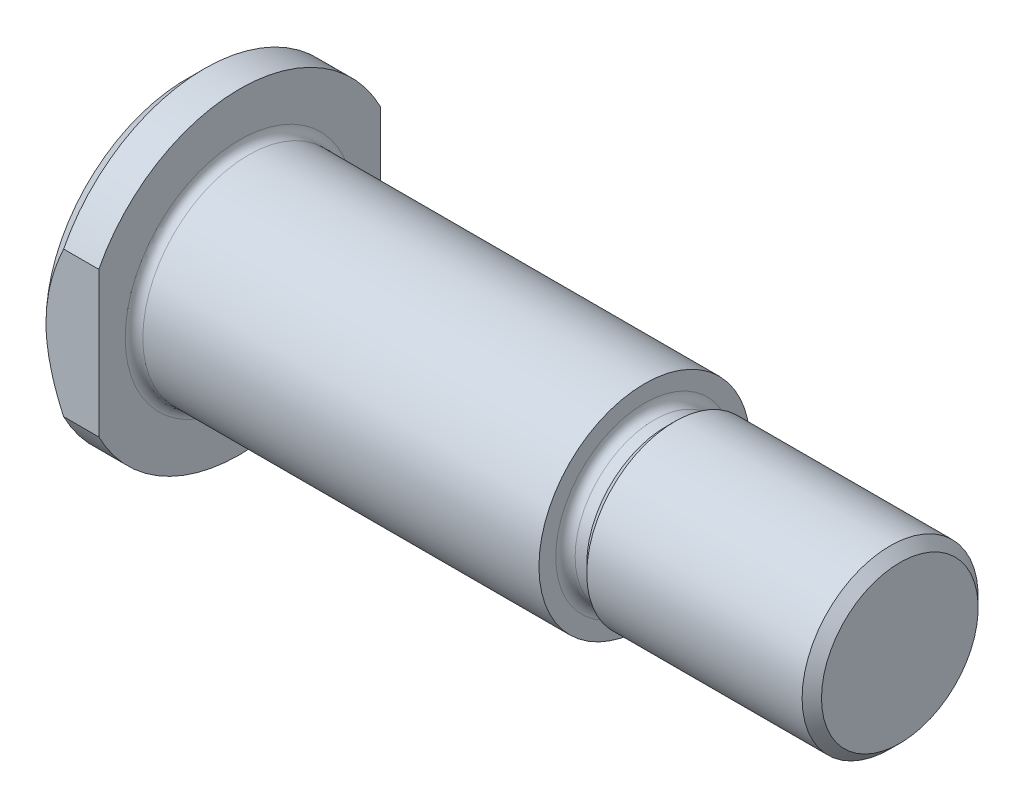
SolidWorks part; units mm, degrees
ref_plane "Plane1" through (0, 0, 0) normal (0, 0, 1) x (1, 0, 0)
ref_plane "Plane2" through (0, 0, 0) normal (0, 1, 0) x (1, 0, 0)
ref_plane "Plane3" through (0, 0, 0) normal (1, 0, 0) x (0, 0, -1)
sketch "BodySke" plane through (0, 0, 0) normal (0, 0, 1) x (1, 0, 0)
  line L0 (0, 0) -> (0, 16)
  line L1 (0, 16) -> (2, 18)
  line L2 (2, 18) -> (6, 18)
  line L3 (6, 18) -> (6, 12)
  line L6 (6, 12) -> (52, 12)
  line L7 (52, 12) -> (52, 10.089)
  line L8 (53.1015, 8.9875) -> (54.4233, 8.9875)
  line L9 (54.4233, 8.9875) -> (55.4358, 10)
  line L10 (55.4358, 10) -> (79.8985, 10)
  line L11 (79.8985, 10) -> (81, 8.8985)
  line L12 (81, 8.8985) -> (81, 0)
  line L13 (81, 0) -> (0, 0)
  line L14 (-6.35, 0) -> (107.95, 0) construction
  line L20 (56.4233, 13.8389) -> (56.4233, -3.5139) construction
  line L21 (53.6522, 12.6746) -> (53.6523, -3.175) construction
  arc A0 (52, 10.089) -> (53.1015, 8.9875) centre (53.1015, 10.089) ccw
  point P29 (52, 8.9875)
  dimension "D2" = 1.1015
  dimension "Head_dia" = 36
  dimension "Head_ht" = 6
  dimension "D3" = 17.975
  dimension "D4" = 45
  dimension "D5" = 45
  dimension "Diameter" = 24
  dimension "Thread_dia" = 20
  dimension "Minor_dia" = 17.797
  dimension "D11" = 45
  dimension "Thread_length" = 29
  dimension "Length" = 75
  dimension "Thread_neck_width" = 2.4233
  dimension "Advance" = 2
  dimension "Thread_nom" = 27.3478
  dimension "Thread_lim" = 24.5767
  dimension "HeadChHt" = 2
revolve "BaseBody" add sketch "BodySke" angle 360 about L14
sketch "Sketch1" plane through (0, 0, 0) normal (-1, 0, 0) x (0, 0, 1)
  line L1 (-16, -18) -> (-18, -18)
  line L2 (-16, -18) -> (-16, 18)
  line L3 (-16, 18) -> (-18, 18)
  line L4 (-18, -18) -> (-18, 18)
  line L5 (18, -18) -> (16, -18)
  line L6 (18, -18) -> (18, 18)
  line L7 (18, 18) -> (16, 18)
  line L8 (16, -18) -> (16, 18)
  dimension "D1" = 36
  dimension "D2" = 18
  dimension "D3" = 16
  dimension "WidthFlats" = 32
  dimension "D4" = 36
  dimension "D5" = 18
extrude "Cut-Extrude1" cut sketch "Sketch1" against normal up to surface (6 mm away)
fillet "Fillet1" radius 1 1 edges at (6, 0, 12)
sketch "ThdSchSke" plane through (0, 0, 0) normal (0, 0, 1) x (1, 0, 0)
  line L0 (56.4233, -8.8985) -> (54.2516, -12)
  line L1 (56.4233, -8.8985) -> (58.595, -12)
  line L2 (58.595, -12) -> (58.595, -15)
  line L3 (-3.175, 0) -> (5.1513, 0) construction
  line L5 (58.595, -15) -> (54.2516, -15)
  line L6 (54.2516, -15) -> (54.2516, -12)
  dimension "Thread_minor" = 17.797
  dimension "Diameter" = 24
  dimension "Start" = 56.4233
  dimension "SideAngle" = 55
  dimension "VeeAngle" = 70
  dimension "Overcut" = 30
revolve "ThreadSchematic" [suppressed] cut sketch "ThdSchSke" angle 360 about L3
pattern_linear "ThdSchPat" [suppressed]
equation "\"Thread_minor@ThreadCosmetic\" = \"Minor_dia@BodySke\""
equation "\"Thread_length@ThreadCosmetic\" = ((sgn( (\"Thread_length@BodySke\" - \"Advance@BodySke\" - \"Thread_neck_width@BodySke\" ) - \"Thread_nom@BodySke\" )-1)*( (\"Thread_length@BodySke\" - \"Advance@BodySke\" - \"Threa"
equation "\"Thread_minor@ThdSchSke\" = \"Minor_dia@BodySke\""
equation "\"Diameter@ThdSchSke\" = \"Diameter@BodySke\""
equation "\"Overcut@ThdSchSke\" = \"Diameter@BodySke\" * 1.25"
equation "\"Start@ThdSchSke\" = \"Head_ht@BodySke\" + \"Length@BodySke\" -  \"Thread_length@ThreadCosmetic\"  '---Non-countersunk---"
equation "\"Num_threads@ThdSchPat\" = int( \"Thread_length@ThreadCosmetic\" / \"Advance@BodySke\" + 0.999 ) + 1"
equation "\"Advance@ThdSchPat\" = \"Thread_length@ThreadCosmetic\" /  (\"Num_threads@ThdSchPat\" - 1) 'relax it"
equation "\"Num_threads@ThdSchPat\" = \"Num_threads@ThdSchPat\" - sgn( \"Num_threads@ThdSchPat\" - 1) '---chamfered tips only---"
equation "\"D3@BodySke\" = \"Minor_dia@BodySke\" * 1.01"
equation "\"D2@BodySke\" = (\"Thread_dia@BodySke\" - \"Minor_dia@BodySke\") / 2"
equation "\"Thread_neck_width@BodySke\" =  ( \"Thread_dia@BodySke\" - \"Minor_dia@BodySke\" )  * 1.1"
equation "\"Thread_nom@BodySke\" = \"Thread_length@BodySke\" - \"D2@BodySke\" * 1.5"
equation "\"D1@Sketch1\" = \"Head_dia@Bodyske\""
equation "\"D2@Sketch1\" = \"D1@Sketch1\" / 2"
equation "\"D3@Sketch1\" = \"WidthFlats@Sketch1\" / 2"
equation "\"D4@Sketch1\" = \"D1@Sketch1\""
equation "\"D5@Sketch1\" = \"D4@Sketch1\" / 2"
